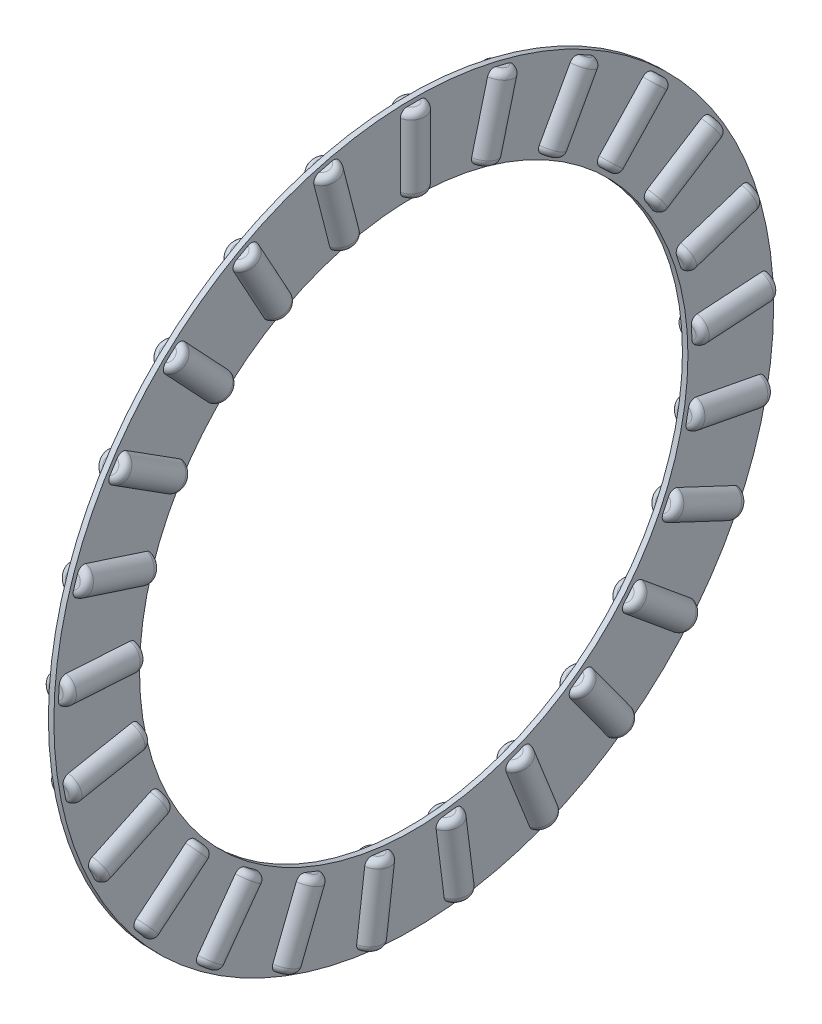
SolidWorks part; units mm, degrees
ref_plane "Plane1" through (0, 0, 0) normal (0, 0, 1) x (1, 0, 0)
ref_plane "Plane2" through (0, 0, 0) normal (0, 1, 0) x (1, 0, 0)
ref_plane "Plane3" through (0, 0, 0) normal (1, 0, 0) x (0, 0, -1)
other "Configuration Table"
sketch "Clipboard" plane through (0, 0, 0) normal (0, 0, 1) x (1, 0, 0)
  line L0 (-10, 0) -> (10, 0) construction
  line L1 (0, 0) -> (20.2657, -9.45)
  line L2 (0, 0) -> (41.9167, 19.5461)
  line L3 (0, 0) -> (20.2657, -9.45)
  line L4 (0, 0) -> (-22.3471, -0.7804)
sketch "CagSpiSke" plane through (0, 0, 0) normal (0, 0, 1) x (1, 0, 0)
  line L5 (-34.925, 0) -> (34.925, 0) construction
  line L6 (-0.4, 52.5) -> (0.4, 52.5)
  line L7 (-0.4, 52.5) -> (-0.4, 40)
  line L8 (-0.4, 40) -> (0.4, 40)
  line L9 (0.4, 52.5) -> (0.4, 40)
revolve "CageSpine" add sketch "CagSpiSke" angle 360 about L5
ref_axis "Axis1" through (-50, 0, 0) along (1, 0, 0)
sketch "RolDetSke" plane through (0, 0, 0) normal (0, 0, 1) x (1, 0, 0)
  line L0 (0, 33.02) -> (0, 55.88) construction
  line L3 (0, 51.875) -> (1.04, 51.875)
  line L4 (0, 51.875) -> (0, 40.625)
  line L5 (0, 40.625) -> (1.04, 40.625)
  line L6 (2, 50.915) -> (2, 41.585)
  arc A0 (2, 41.585) -> (1.04, 40.625) centre (1.04, 41.585) cw
  arc A1 (1.04, 51.875) -> (2, 50.915) centre (1.04, 50.915) cw
revolve "RollerDetailed" add sketch "RolDetSke" angle 360 about L0
pattern_circular "RollersDetailed" count 25 every 14.4 about axis through (-50, 0, 0) along (1, 0, 0) of "RollerDetailed"
sketch "RolSimSke" plane through (0, 0, 0) normal (0, 0, 1) x (1, 0, 0)
  line L1 (-17.78, 0) -> (12.7, 0) construction
  line L3 (-1.04, 51.875) -> (1.04, 51.875)
  line L4 (-2, 50.915) -> (-2, 41.585)
  line L5 (-1.04, 40.625) -> (1.04, 40.625)
  line L6 (2, 50.915) -> (2, 41.585)
  arc A0 (-2, 41.585) -> (-1.04, 40.625) centre (-1.04, 41.585) ccw
  arc A1 (-1.04, 51.875) -> (-2, 50.915) centre (-1.04, 50.915) ccw
  arc A2 (2, 50.915) -> (1.04, 51.875) centre (1.04, 50.915) ccw
  arc A3 (1.04, 40.625) -> (2, 41.585) centre (1.04, 41.585) ccw
revolve "RollersSimplified" [suppressed] add sketch "RolSimSke" angle 360 about L1
equation "\"BallCLRad@Clipboard\" =  ( \"OD@CagSpiSke\" + \"ID@CagSpiSke\" )  / 4"
equation "\"offset@RolSimSke\" = \"BallCLRad@Clipboard\" - \"Cyl_Len@RolSimSke\" / 2"
equation "\"offset@RolDetSke\" = \"BallCLRad@Clipboard\" - \"Cyl_Len@RolDetSke\" / 2"
equation "\"Thickness@CagSpiSke\" =  \"Roller_diameter@RolDetSke\" * 0.2"
equation "\"HalfThick@CagSpiSke\" = \"Thickness@CagSpiSke\" / 2"
equation "\"radius@RolDetSke\" =  ( \"Roller_diameter@RolDetSke\" - \"Thickness@CagSpiSke\" )  * 0.6 / 2"
equation "\"Roller_diameter@RolSimSke\" = \"Roller_diameter@RolDetSke\""
equation "\"Cyl_Len@RolSimSke\" = \"Cyl_Len@RolDetSke\""
equation "\"Rol_rad@RolSimSke\" = \"radius@RolDetSke\""
equation "\"Halfdia@RolSimSke\" = \"Roller_diameter@RolSimSke\" / 2"
equation "\"Max_count@Clipboard\" = int( 3.14159265 / atn(( \"Roller_diameter@RolDetSke\" / 2) / sqr( \"offset@RolDetSke\"  *  \"offset@RolDetSke\" - ( \"Roller_diameter@RolDetSke\" / 2) *  ( \"Roller_diameter@RolDetSke\" "
equation "\"Max_count@Clipboard\" = ((sgn( \"Max_count@Clipboard\" - \"Count@Clipboard\" )-1)*( \"Max_count@Clipboard\" - \"Count@Clipboard\" ))/-2+ \"Count@Clipboard\""
equation "\"Count@RollersDetailed\" = int( \"Show_count@Clipboard\" ) "
equation "\"Count@RollersDetailed\" = ((sgn( \"Count@RollersDetailed\" - \"Max_count@Clipboard\" )-1)*( \"Count@RollersDetailed\" - \"Max_count@Clipboard\" ))/-2+ \"Max_count@Clipboard\""
equation "\"Count@RollersDetailed\" = ((sgn( \"Count@RollersDetailed\" - \"Min_count@Clipboard\" )+1)*( \"Count@RollersDetailed\" - \"Min_count@Clipboard\"))/2 +\"Min_count@Clipboard\""
equation "\"Angle@RollersDetailed\" = 360.0 / \"Max_count@Clipboard\""
